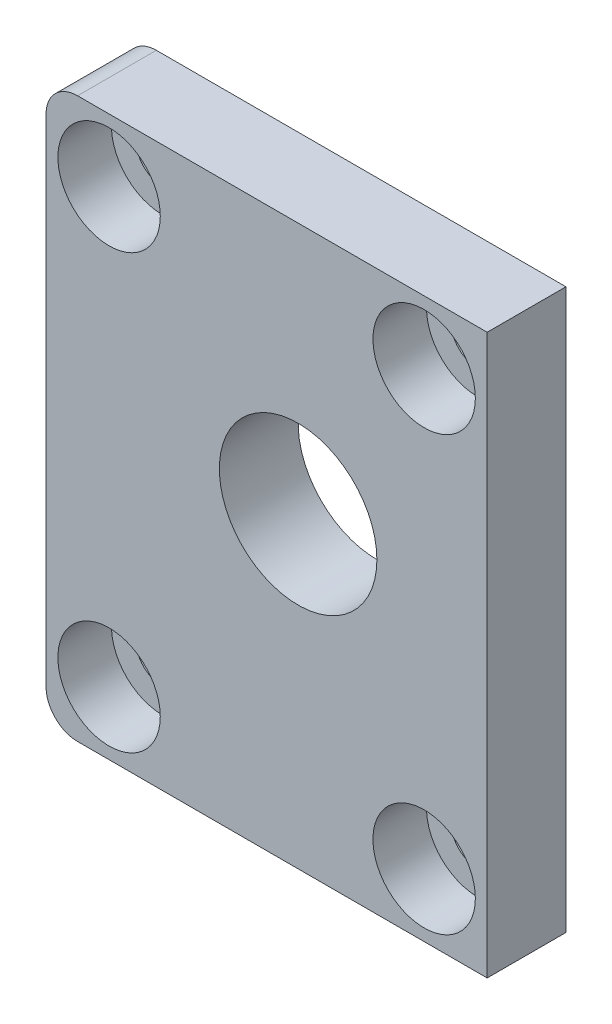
SolidWorks part; units mm, degrees
ref_plane "Ebene vorne" through (0, 0, 0) normal (0, 0, 1) x (1, 0, 0)
ref_plane "Ebene oben" through (0, 0, 0) normal (0, 1, 0) x (1, 0, 0)
ref_plane "Ebene rechts" through (0, 0, 0) normal (1, 0, 0) x (0, 0, -1)
sketch "Skizze1" plane through (0, 0, 0) normal (0, 0, 1) x (1, 0, 0)
  line L0 (-14, 0) -> (0, 0) construction
  line L1 (-14, -17.75) -> (14, -17.75)
  line L2 (-14, -17.75) -> (-14, 17.75)
  line L3 (-14, 17.75) -> (14, 17.75)
  line L4 (14, -17.75) -> (14, 17.75)
  line L5 (0, 0) -> (0, -17.75) construction
  circle A0 centre (2, 1.75) radius 5
  point P0 (0, 0)
  dimension "D3" = 10
  dimension "D4" = 16
  dimension "D5" = 12
  dimension "D1" = 28
  dimension "D2" = 35.5
extrude "Aufsatz-Linear austragen1" add sketch "Skizze1" along normal blind 5
hole_wizard "Stirnsenkung für M3 Zylinderschraube mit Innensechskant1" positions "Skizze2" profile "Skizze3" counterbore size "M3" standard "DIN"
sketch "Skizze2" plane through (0, 0, 5) normal (0, 0, 1) x (1, 0, 0)
  line L0 (-14, 17.75) -> (-14, -17.75) construction
  line L1 (14, 17.75) -> (-14, 17.75) construction
  line L2 (-14, -17.75) -> (14, -17.75) construction
  line L3 (14, -17.75) -> (14, 17.75) construction
  point P0 (-10, 13.75)
  point P2 (10, 13.75)
  point P4 (10, -13.75)
  point P6 (-10, -13.75)
  dimension "D1" = 4
  dimension "D2" = 4
  dimension "D3" = 4
  dimension "D4" = 4
sketch "Skizze3" plane through (-10, 13.75, 5) normal (1, 0, 0) x (0, -1, 0)
  line L0 (0, 0) -> (0, 5)
  line L1 (0, 5) -> (1.7, 5)
  line L3 (1.7, 5) -> (1.7, 3.4)
  line L4 (1.7, 3.4) -> (3.25, 3.4)
  line L5 (3.25, 3.4) -> (3.25, 0)
  line L7 (3.25, 0) -> (0, 0)
  line L11 (0, -6.35) -> (0, 107.95) construction
  dimension "Bohrerdurchmesser" = 3.4
  dimension "Bohrungstiefe" = 5
  dimension "Senkdurchmesser2" = 6.5
  dimension "Senktiefe2" = 3.4
fillet "Verrundung1" radius 2 2 edges at (-14, -17.75, 2.5) (-14, 17.75, 2.5)
